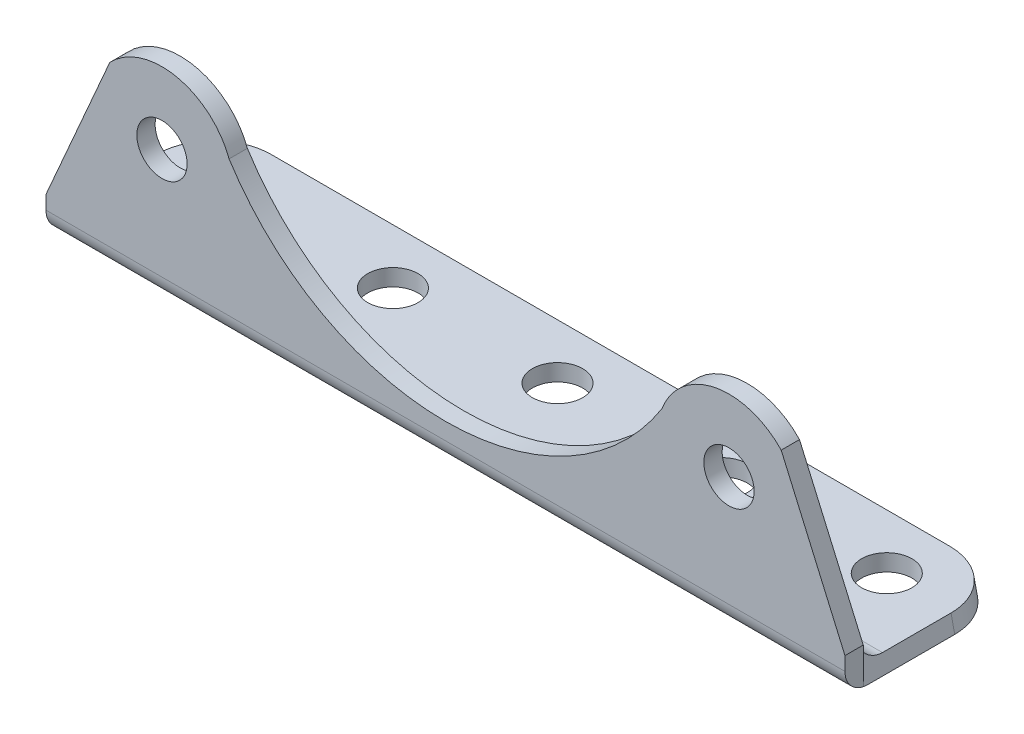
SolidWorks part; units mm, degrees
ref_plane "Front" through (0, 0, 0) normal (0, 0, 1) x (1, 0, 0)
ref_plane "Top" through (0, 0, 0) normal (0, 1, 0) x (1, 0, 0)
ref_plane "Right" through (0, 0, 0) normal (1, 0, 0) x (0, 0, -1)
sketch "Sketch1" plane through (0, 0, 0) normal (0, 0, 1) x (1, 0, 0)
  line L0 (22.1894, -16.4267) -> (22.1894, -14.3947)
  line L1 (18.6477, -6.2812) -> (22.1894, -14.3947)
  line L3 (22.1894, -16.4267) -> (-22.1894, -16.4267)
  line L5 (-22.1894, -16.4267) -> (-22.1894, -14.3947)
  line L6 (-18.6477, -6.2812) -> (-22.1894, -14.3947)
  arc A0 (-12.0193, -7.6065) -> (12.0193, -7.6065) centre (0, 0) ccw
  arc A1 (18.6477, -6.2812) -> (12.0193, -7.6065) centre (15.748, -9.017) ccw
  circle A2 centre (-15.748, -9.017) radius 1.397
  arc A3 (-18.6477, -6.2812) -> (-12.0193, -7.6065) centre (-15.748, -9.017) cw
  circle A6 centre (15.748, -9.017) radius 1.397
  point P16 (0, -16.4267)
  dimension "D2" = 15.748
  dimension "D1" = 15.748
extrude "Base-Extrude" add sketch "Sketch1" along normal blind 1.016
sketch "Sketch4" plane through (0, 0, 0) normal (0, 0, -1) x (-1, 0, 0)
  line L0 (22.1373, -15.494) -> (-21.9847, -15.494)
  line L1 (22.1373, -15.494) -> (22.1894, -16.4267)
  line L3 (-22.1894, -16.4267) -> (22.1894, -16.4267)
  line L5 (-21.9847, -15.494) -> (-22.1894, -16.4267)
extrude "Boss-Extrude3" add sketch "Sketch4" along normal blind 8.255
sketch "Sketch5" plane through (0, -16.4267, 0) normal (0, -1, 0) x (1, 0, 0)
  line L0 (0, 1.016) -> (0, 0) construction
  circle A0 centre (0, -5.207) radius 1.397
  circle A1 centre (9.144, -5.207) radius 1.397
  circle A2 centre (18.288, -5.207) radius 1.397
  circle A3 centre (-9.144, -5.207) radius 1.397
  circle A4 centre (-18.288, -5.207) radius 1.397
extrude "Cut-Extrude1" cut sketch "Sketch5" against normal through all
fillet "Fillet5" radius 3.175
fillet "Fillet6" radius 3.175
fillet "Fillet7" radius 1.27
fillet "Fillet8" radius 1.27
